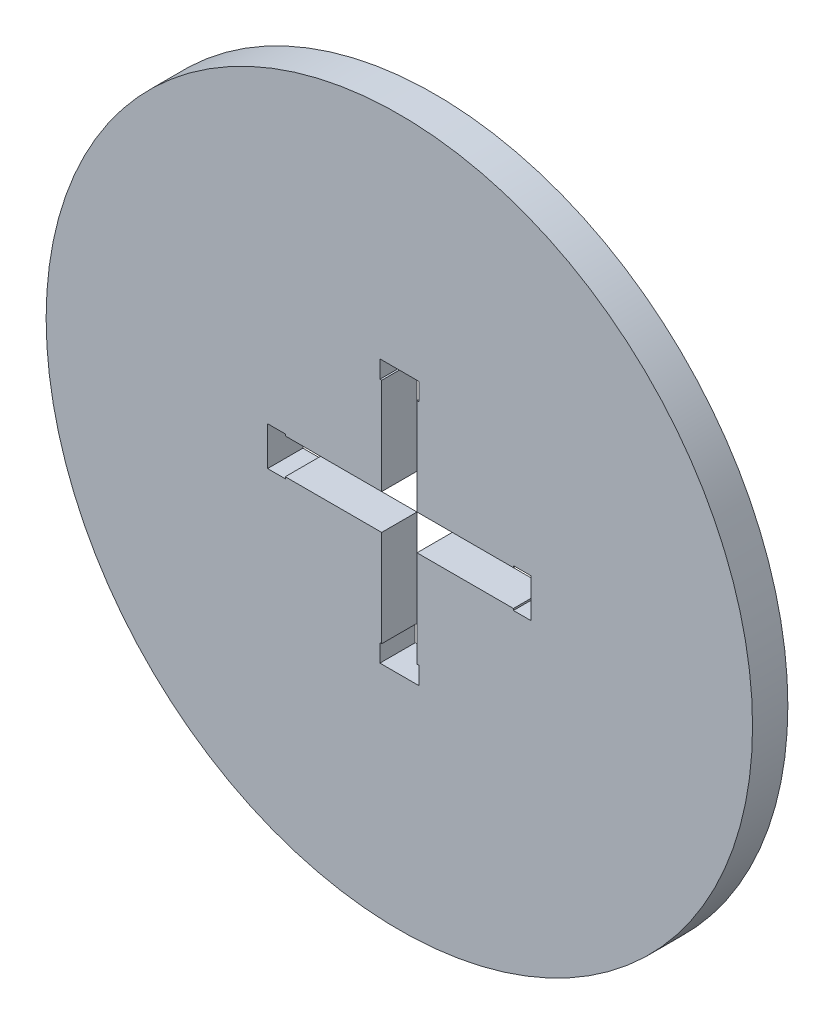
SolidWorks part; units mm, degrees
ref_plane "Alzado" through (0, 0, 0) normal (0, 0, 1) x (1, 0, 0)
ref_plane "Planta" through (0, 0, 0) normal (0, 1, 0) x (1, 0, 0)
ref_plane "Vista lateral" through (0, 0, 0) normal (1, 0, 0) x (0, 0, -1)
sketch "Croquis2" plane through (0, 0, 0) normal (0, 0, 1) x (1, 0, 0)
  circle A0 centre (0, 0) radius 127
  dimension "D1" = 254
extrude "Saliente-Extruir1" add sketch "Croquis2" along normal blind 12.7
sketch "Croquis3" plane through (0, 0, 12.7) normal (0, 0, 1) x (1, 0, 0)
  line L0 (0, 127) -> (0, -127) construction
  line L1 (-127, 0) -> (127, 0) construction
  line L2 (6.35, 47.371) -> (-6.35, 47.371)
  line L3 (-6.35, 47.371) -> (-6.35, 6.35)
  line L4 (-6.35, 6.35) -> (-47.371, 6.35)
  line L5 (-47.371, 6.35) -> (-47.371, -6.35)
  line L6 (-47.371, -6.35) -> (-6.35, -6.35)
  line L7 (-6.35, -6.35) -> (-6.35, -47.371)
  line L8 (-6.35, -47.371) -> (6.35, -47.371)
  line L9 (6.35, -6.35) -> (6.35, -47.371)
  line L10 (47.371, -6.35) -> (6.35, -6.35)
  line L11 (47.371, 6.35) -> (47.371, -6.35)
  line L12 (6.35, 6.35) -> (47.371, 6.35)
  line L13 (6.35, 47.371) -> (6.35, 6.35)
  circle A0 centre (0, 0) radius 127 construction
  point P9 (-47.371, 0)
  point P19 (0, -47.371)
  point P24 (0, 47.371)
  dimension "D1" = 6.35
  dimension "D2" = 12.7
  dimension "D3" = 94.742
  dimension "D4" = 94.742
extrude "Cortar-Extruir1" cut sketch "Croquis3" against normal through all contours L8 L9 L10 L11 L12 L13 L2 L3 L4 L5 L6 L7
sketch "Croquis4" plane through (0, 0, 12.7) normal (0, 0, 1) x (1, 0, 0)
  line L1 (6.35, 47.371) -> (6.985, 47.371)
  line L2 (6.35, 47.371) -> (6.35, 41.021)
  line L3 (6.35, 41.021) -> (6.985, 41.021)
  line L4 (6.985, 47.371) -> (6.985, 41.021)
  line L5 (-6.35, 47.371) -> (-6.985, 47.371)
  line L6 (-6.35, 47.371) -> (-6.35, 41.021)
  line L7 (-6.35, 41.021) -> (-6.985, 41.021)
  line L8 (-6.985, 47.371) -> (-6.985, 41.021)
  line L9 (-47.371, 6.35) -> (-41.021, 6.35)
  line L10 (-47.371, 6.35) -> (-47.371, 6.985)
  line L11 (-47.371, 6.985) -> (-41.021, 6.985)
  line L12 (-41.021, 6.35) -> (-41.021, 6.985)
  line L13 (-47.371, -6.35) -> (-41.021, -6.35)
  line L14 (-47.371, -6.35) -> (-47.371, -6.985)
  line L15 (-47.371, -6.985) -> (-41.021, -6.985)
  line L16 (-41.021, -6.35) -> (-41.021, -6.985)
  dimension "D1" = 6.35
  dimension "D2" = 0.635
  dimension "D3" = 6.35
  dimension "D4" = 0.635
  dimension "D5" = 6.35
  dimension "D6" = 0.635
  dimension "D7" = 6.35
  dimension "D8" = 0.635
extrude "Cortar-Extruir2" cut sketch "Croquis4" against normal through all
mirror "Simetría1" about plane through (0, 0, 0) normal (0, 1, 0) of "Cortar-Extruir2"
mirror "Simetría2" about plane through (0, 0, 0) normal (1, 0, 0) of "Simetría1"
